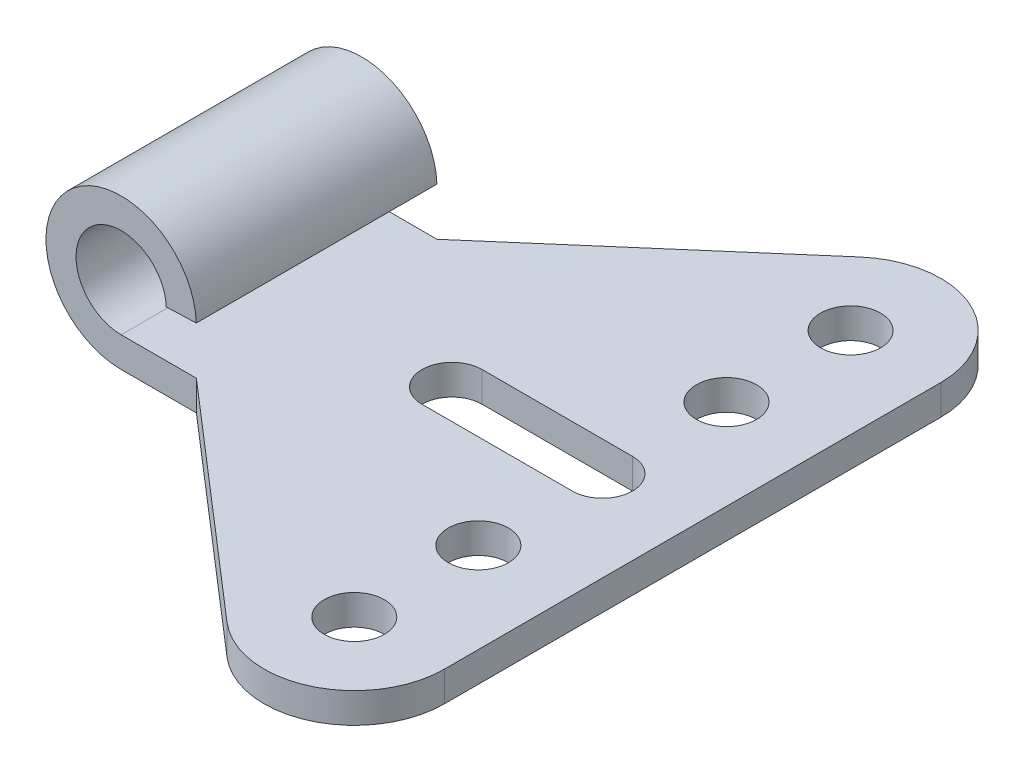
SolidWorks part; units mm, degrees
ref_plane "Front" through (0, 0, 0) normal (0, 0, 1) x (1, 0, 0)
ref_plane "Top" through (0, 0, 0) normal (0, 1, 0) x (1, 0, 0)
ref_plane "Right" through (0, 0, 0) normal (1, 0, 0) x (0, 0, -1)
sketch "Sketch1" plane through (0, 0, 0) normal (0, 0, 1) x (1, 0, 0)
  line L0 (0, -5) -> (5, -5)
  line L1 (0, 0) -> (40.441, 0) construction
  line L2 (0, 0) -> (4.997, 0.1745) construction
  arc A0 (4.997, 0.1745) -> (0, -5) centre (0, 0) ccw
  dimension "D1" = 5
  dimension "D2" = 5
  dimension "D3" = 2
extrude "Base-Extrude-Thin" add sketch "Sketch1" along normal mid plane 16 thin
sketch "Sketch2" plane through (0, -3, 0) normal (0, 1, 0) x (-1, 0, 0)
  line L0 (-5, 0) -> (-45, 0) construction
  line L1 (-5, 8) -> (-5, -8) construction
  line L2 (-5, -8) -> (-5, 8)
  line L3 (-5, 8) -> (-20.075, 21.0381)
  line L5 (-30, -16.5) -> (-30, 16.5)
  line L7 (-5, -8) -> (-20.075, -21.0381)
  arc A0 (-20.075, 21.0381) -> (-30, 16.5) centre (-24, 16.5) ccw
  arc A1 (-20.075, -21.0381) -> (-30, -16.5) centre (-24, -16.5) cw
  point P10 (-30, 0)
  point P13 (-5, 0)
  dimension "D1" = 45
  dimension "D2" = 6
  dimension "D3" = 30
extrude "Boss-Extrude1" add sketch "Sketch2" against normal up to next (2 mm away)
sketch "Sketch3" plane through (0, -3, 0) normal (0, 1, 0) x (-1, 0, 0)
  line L0 (-24, 0) -> (-24, 16.5) construction
  line L1 (-24, 0) -> (0, 0) construction
  line L2 (-24, -2) -> (-14, -2)
  line L3 (-24, 2) -> (-14, 2)
  circle A0 centre (-24, 16.5) radius 2
  circle A1 centre (-24, 8.25) radius 2
  arc A2 (-20.075, 21.0381) -> (-30, 16.5) centre (-24, 16.5) ccw construction
  arc A4 (-24, -2) -> (-24, 2) centre (-24, 0) cw
  arc A5 (-14, -2) -> (-14, 2) centre (-14, 0) ccw
  circle A6 centre (-24, -16.5) radius 2
  circle A7 centre (-24, -8.25) radius 2
  dimension "D1" = 4
  dimension "D3" = 10
  dimension "D2" = 4
extrude "Cut-Extrude1" cut sketch "Sketch3" against normal through all
